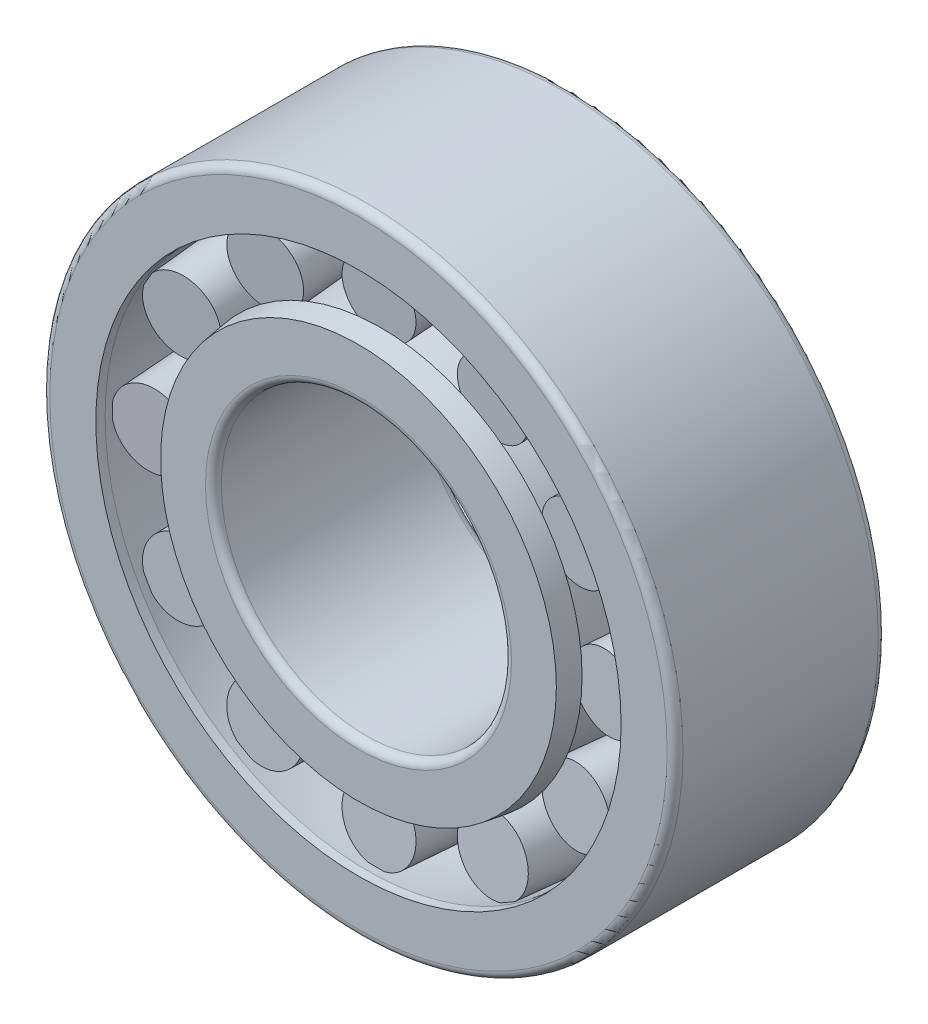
SolidWorks part; units mm, degrees
ref_plane "Front Plane" through (0, 0, 0) normal (0, 0, 1) x (1, 0, 0)
ref_plane "Top Plane" through (0, 0, 0) normal (0, 1, 0) x (1, 0, 0)
ref_plane "Right Plane" through (0, 0, 0) normal (1, 0, 0) x (0, 0, -1)
sketch "BaseSke" plane through (0, 0, 0) normal (1, 0, 0) x (0, 0, -1)
  line L0 (-47.2296, 0) -> (69.4868, 0) construction
  line L2 (0, 129.5214) -> (0, 102.0515) construction
  line L3 (-40, 55) -> (-40, 75) construction
  line L4 (-40, 120) -> (40, 120) construction
  line L5 (-40, 55) -> (40, 55) construction
  line L7 (40, 55) -> (40, 75) construction
  line L8 (40, 99) -> (40, 120) construction
  line L9 (-40, 99) -> (-40, 120) construction
  line L11 (0, 90.2041) -> (-40, 87) construction
  line L12 (0, 90.2041) -> (40, 87) construction
  line L13 (-40, 99) -> (-40, 75) construction
  line L14 (0, 78.3568) -> (0, -86.3012) construction
  line L15 (0, 102.0515) -> (0, 78.3568) construction
  line L16 (-32.2167, 86.2859) -> (-31.1, 72.3457) construction
  line L17 (-33.3333, 100.226) -> (-6.7518, 102.3553)
  line L18 (-33.3333, 100.226) -> (-32.2167, 86.2859)
  line L19 (-31.1, 72.3457) -> (-4.5185, 74.475) construction
  line L20 (-6.7518, 102.3553) -> (-5.6352, 88.4151)
  line L21 (-4.5185, 74.475) -> (-5.6352, 88.4151) construction
  line L22 (-32.2167, 86.2859) -> (-5.6352, 88.4151)
  line L23 (-40, 85.6624) -> (0, 88.8665) construction
  arc A1 (-40, 99) -> (40, 99) centre (0, -161.6432) cw construction
  arc A2 (40, 75) -> (-40, 75) centre (0, -161.6432) ccw construction
  dimension "D2" = 20
  dimension "D1" = 240
  dimension "Bearing_Thickness" = 80
  dimension "Bearing_Outside_Diameter" = 240
  dimension "Bearing_Inside_Diameter" = 110
  dimension "D3" = 21
  dimension "D4" = 26.6667
  dimension "D5" = 6.6667
  dimension "D6" = 1.3333
revolve "Roller" add sketch "BaseSke" angle 360 about L23
sketch "OuterRaceSke" plane through (0, 0, 0) normal (1, 0, 0) x (0, 0, -1)
  line L0 (0, 0) -> (0, 94.5438) construction
  line L1 (-40, 120) -> (40, 120)
  line L2 (-40, 120) -> (-40, 98.9798)
  line L3 (40, 120) -> (40, 98.9798)
  line L5 (-50.3916, 0) -> (55.2197, 0) construction
  arc A0 (-40, 98.9798) -> (40, 98.9798) centre (0, -161.6432) cw
  arc A2 (40, 99) -> (-40, 99) centre (0, -161.6432) ccw construction
  dimension "D1" = 0.02
revolve "OuterRace" add sketch "OuterRaceSke" angle 360 about L5
sketch "InnerRaceSke" plane through (0, 0, 0) normal (1, 0, 0) x (0, 0, -1)
  line L0 (-70.8626, 0) -> (113.5527, 0) construction
  line L1 (0, 90.393) -> (0, -90.393) construction
  line L2 (-40, 55) -> (40, 55)
  line L3 (-40, 55) -> (-40, 75)
  line L4 (-31.5154, 76.2786) -> (-31.2013, 72.3577)
  line L5 (-31.2013, 72.3577) -> (-4.4204, 74.5029)
  line L7 (-4.4204, 74.5029) -> (-4.7254, 78.3103)
  line L8 (-32.2167, 86.2859) -> (-31.1, 72.3457) construction
  line L9 (4.4204, 74.5029) -> (4.7254, 78.3103)
  line L10 (-4.5185, 74.475) -> (-5.6352, 88.4151) construction
  line L11 (-31.1, 72.3457) -> (-4.5185, 74.475) construction
  line L14 (31.2013, 72.3577) -> (4.4204, 74.5029)
  line L15 (31.5154, 76.2786) -> (31.2013, 72.3577)
  line L16 (40, 55) -> (40, 75)
  arc A0 (-40, 75) -> (-31.5154, 76.2786) centre (0, -161.6432) cw
  arc A1 (40, 75) -> (-40, 75) centre (0, -161.6432) ccw construction
  arc A2 (-4.7254, 78.3103) -> (4.7254, 78.3103) centre (0, -161.6432) cw
  arc A3 (40, 75) -> (31.5154, 76.2786) centre (0, -161.6432) ccw
  point P38 (0, 55)
  dimension "D2" = 0.1
  dimension "D1" = 0.02
  dimension "D3" = 0.1
revolve "InnerRace" add sketch "InnerRaceSke" angle 360 about L0
mirror "MirrorRoller" about plane through (0, 0, 0) normal (0, 0, 1) of "Roller"
fillet "Fillet1" radius 3 4 edges at (55, 0, 40) (120, 0, 40) (55, 0, -40) (120, 0, -40)
sketch "CutGrooveSke" plane through (0, 0, 0) normal (1, 0, 0) x (0, 0, -1)
  line L0 (-51.8407, 0) -> (83.8302, 0) construction
  line L1 (-20, -137.6) -> (-24, -137.6)
  line L2 (-20, -137.6) -> (-20, -117.6)
  line L3 (-20, -117.6) -> (-24, -117.6)
  line L4 (-24, -137.6) -> (-24, -117.6)
  dimension "D1" = 117.6
  dimension "D2" = 20
  dimension "D3" = 4
  dimension "D4" = 20
revolve "CutGroove" [suppressed] cut sketch "CutGrooveSke" angle 360 about L0
sketch "TaperSke" plane through (0, 0, 0) normal (1, 0, 0) x (0, 0, -1)
  line L0 (-40, 55) -> (40, 55)
  line L1 (40, 55) -> (40, 61.6667)
  line L2 (40, 61.6667) -> (-40, 55)
  line L7 (-41.2502, 0) -> (40.8606, 0) construction
  dimension "Taper" = 6.6667
revolve "Taper" [suppressed] cut sketch "TaperSke" angle 360 about L7
fillet "Fillet2" [suppressed] radius 3
pattern_circular "CirPatternBall" count 12 over 360 about axis through (0, 0, 0) along (0, 0, 1) of "Roller", "MirrorRoller"
sketch "SimplifiedSke" plane through (0, 0, 0) normal (1, 0, 0) x (0, 0, -1)
  line L0 (37.5911, 0) -> (-37.5911, 0) construction
  line L1 (0, 0) -> (0, 96.8272) construction
  line L2 (-31.1, 72.3457) -> (-4.5185, 74.475)
  line L3 (-31.1, 72.3457) -> (-33.3333, 100.226)
  line L4 (-33.3333, 100.226) -> (-6.7518, 102.3553)
  line L5 (-4.5185, 74.475) -> (-6.7518, 102.3553)
  line L7 (4.5185, 74.475) -> (6.7518, 102.3553)
  line L8 (31.1, 72.3457) -> (4.5185, 74.475)
  line L9 (31.1, 72.3457) -> (33.3333, 100.226)
  line L10 (33.3333, 100.226) -> (6.7518, 102.3553)
revolve "Simplified" [suppressed] add sketch "SimplifiedSke" angle 360 about L0
chamfer "Chamfer" distance 3.3333 angle 10 2 edges at (98.9798, 0, -40) (98.9798, 0, 40)
equation "\"D1@BaseSke\" = \"Bearing_Thickness@BaseSke\"*3"
equation "\"D2@BaseSke\" =  ( \"Bearing_Outside_Diameter@BaseSke\" - \"Bearing_Inside_Diameter@BaseSke\" ) /6.5"
equation "\"D3@BaseSke\" = \"D2@BaseSke\"*1.05"
equation "\"D4@BaseSke\" = \"Bearing_Thickness@BaseSke\"/3"
equation "\"D5@BaseSke\" = \"Bearing_Thickness@BaseSke\"/12"
equation "\"D6@BaseSke\" = \"Bearing_Thickness@BaseSke\"/60"
equation "\"D1@CutGrooveSke\" = \"Bearing_Outside_Diameter@BaseSke\" * 0.49"
equation "\"D2@CutGrooveSke\" = \"Bearing_Thickness@BaseSke\" *0.25"
equation "\"D3@CutGrooveSke\" = \"Bearing_Thickness@BaseSke\"/20"
equation "\"Taper@TaperSke\" = \"Bearing_Thickness@BaseSke\"/12"
equation "\"D1@Fillet2\" = \"Fillet_radius@Fillet1\""
equation "\"D1@CirPatternBall\" =  int(  ( \"Bearing_Outside_Diameter@BaseSke\" + \"Bearing_Inside_Diameter@BaseSke\" )  / 2 *  pi  /  ( \"Bearing_Outside_Diameter@BaseSke\" - \"Bearing_Inside_Diameter@BaseSke\" ) * 3 ) "
equation "\"D1@Chamfer\" = \"Bearing_Thickness@BaseSke\"/24"
